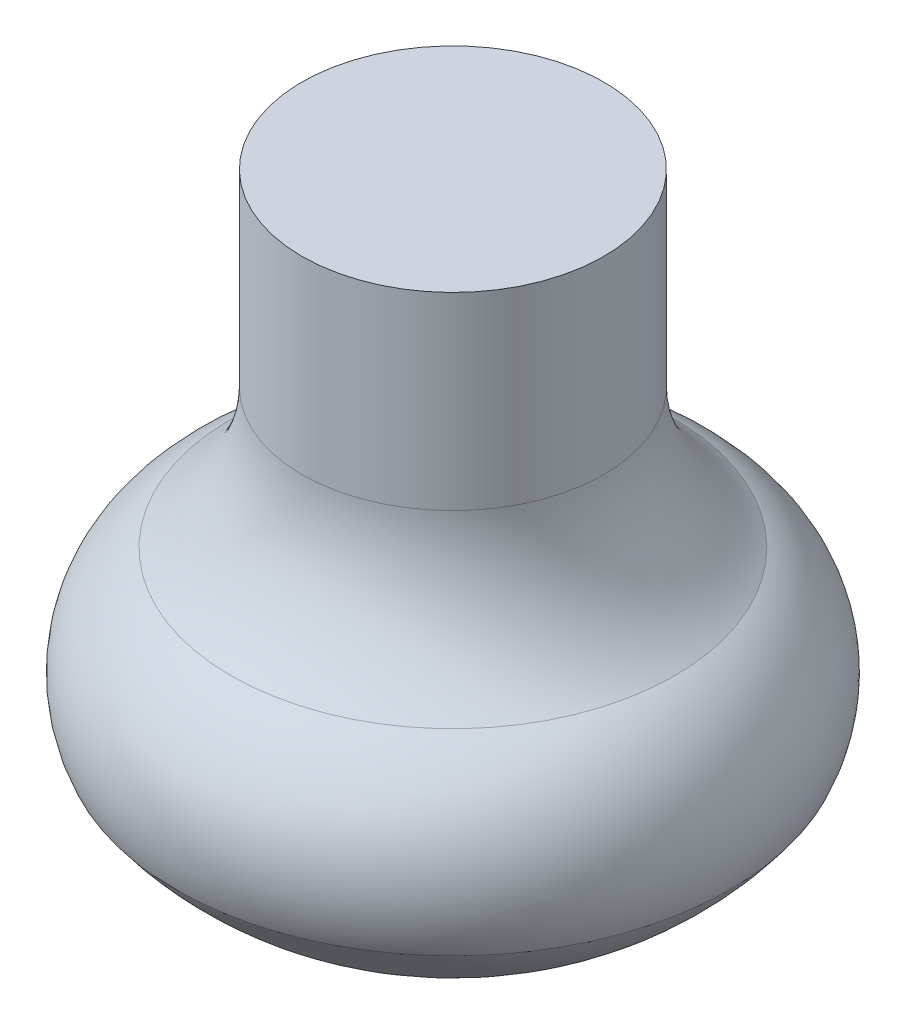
SolidWorks part; units mm, degrees
ref_plane "Front Plane" through (0, 0, 0) normal (0, 0, 1) x (1, 0, 0)
ref_plane "Top Plane" through (0, 0, 0) normal (0, 1, 0) x (1, 0, 0)
ref_plane "Right Plane" through (0, 0, 0) normal (1, 0, 0) x (0, 0, -1)
sketch "Sketch1" plane through (0, 0, 0) normal (0, 0, 1) x (1, 0, 0)
  line L0 (0, 0) -> (0, 60) construction
  line L1 (0, 0) -> (27.5, 0) construction
  line L2 (15, 41.2271) -> (15, 60)
  line L3 (15, 60) -> (0, 60)
  line L4 (0, 60) -> (0, 0)
  arc A0 (0, 0) -> (27.5, 11.7704) centre (3.9381, 28.8093) ccw
  arc A1 (27.5, 11.7704) -> (22.0541, 27.454) centre (16.494, 16.7361) ccw
  arc A2 (22.0541, 27.454) -> (15, 41.2271) centre (31.973, 41.2271) cw
  point P10 (0, 0)
  point P12 (10, 47.5645)
  point P13 (20.204, 28.8093)
  point P14 (16.494, 28.8093)
  point P15 (15, 47.1555)
  dimension "D1" = 60
  dimension "D2" = 27.5
  dimension "D3" = 15
revolve "Revolve1" add sketch "Sketch1" angle 360 about L4
